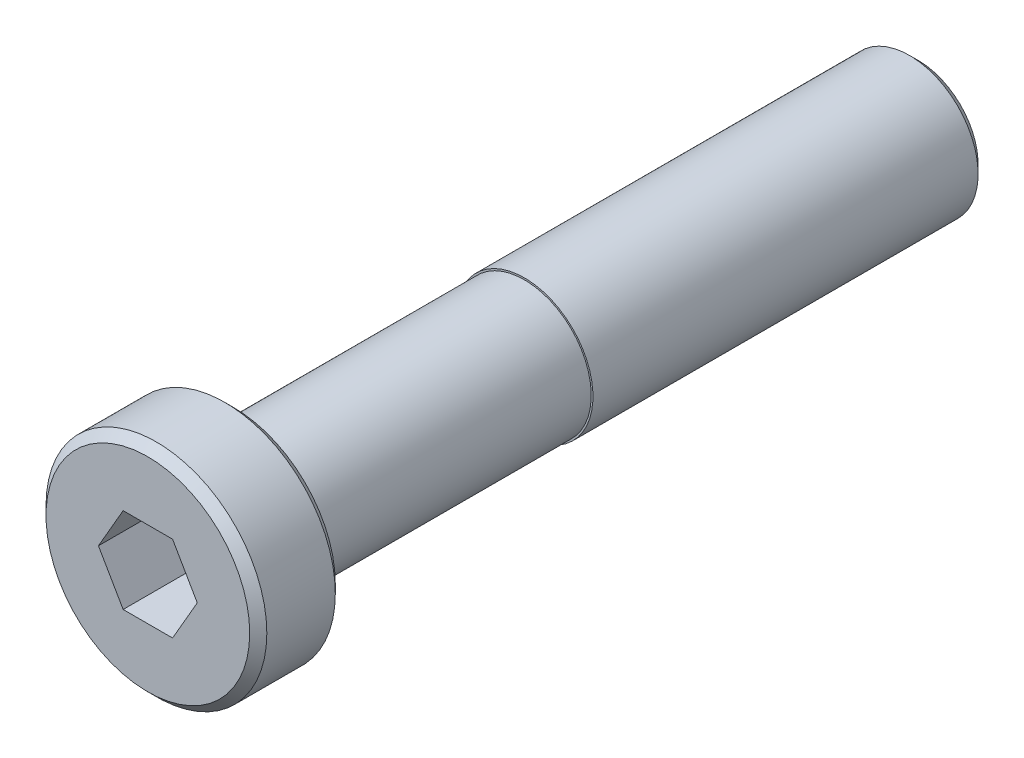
SolidWorks part; units mm, degrees
ref_plane "正面" through (0, 0, 0) normal (0, 0, 1) x (1, 0, 0)
ref_plane "平面" through (0, 0, 0) normal (0, 1, 0) x (1, 0, 0)
ref_plane "右側面" through (0, 0, 0) normal (1, 0, 0) x (0, 0, -1)
sketch "ｽｹｯﾁ1" plane through (0, 0, 0) normal (0, 0, 1) x (1, 0, 0)
  circle A0 centre (0, 0) radius 6.45
  dimension "D1" = 12.9
extrude "ﾎﾞｽ - 押し出し1" add sketch "ｽｹｯﾁ1" along normal blind 5
sketch "ｽｹｯﾁ2" plane through (0, 0, 0) normal (0, 0, -1) x (-1, 0, 0)
  circle A0 centre (0, 0) radius 3.9
  dimension "D1" = 7.8
extrude "ﾎﾞｽ - 押し出し2" add sketch "ｽｹｯﾁ2" along normal blind 40
sketch "ｽｹｯﾁ3" plane through (0, 0, 5) normal (0, 0, 1) x (1, 0, 0)
  line L1 (2.8868, 0) -> (1.4434, 2.5)
  line L2 (1.4434, 2.5) -> (-1.4434, 2.5)
  line L3 (-1.4434, 2.5) -> (-2.8868, 0)
  line L4 (-2.8868, 0) -> (-1.4434, -2.5)
  line L5 (-1.4434, -2.5) -> (1.4434, -2.5)
  line L6 (1.4434, -2.5) -> (2.8868, 0)
  circle A0 centre (0, 0) radius 2.5 construction
  dimension "D1" = 5
extrude "ｶｯﾄ - 押し出し1" cut sketch "ｽｹｯﾁ3" against normal blind 3.8
hole_wizard "Ø5.0 (5) 直径の穴1" positions "ｽｹｯﾁ4" profile "ｽｹｯﾁ6" hole size "Ø5.0" standard "JIS"
sketch "ｽｹｯﾁ4" plane through (0, 0, 5) normal (0, 0, 1) x (1, 0, 0)
  point P0 (0, 0)
sketch "ｽｹｯﾁ6" plane through (0, 0, 5) normal (1, 0, 0) x (0, -1, 0)
  line L0 (0, 0) -> (0, 5.3022)
  line L1 (0, 5.3022) -> (2.5, 3.8)
  line L2 (2.5, 3.8) -> (2.5, 0)
  line L5 (2.5, 0) -> (0, 0)
  line L10 (0, 5.3022) -> (-2.5, 3.8) construction
  line L11 (0, -6.35) -> (0, 107.95) construction
  dimension "穴の直径" = 5
  dimension "穴の深さ" = 3.8
  dimension "ﾄﾞﾘﾙ角度" = 118
chamfer "面取り2" distance 0.5 angle 45 2 edges at (6.45, 0, 0) (6.45, 0, 5)
sketch "ｽｹｯﾁ7" plane through (0, 0, -40) normal (0, 0, -1) x (-1, 0, 0)
  circle A0 centre (0, 0) radius 4
  dimension "D1" = 8
extrude "ﾎﾞｽ - 押し出し3" add sketch "ｽｹｯﾁ7" against normal blind 23
chamfer "面取り1" distance 0.5 angle 45 1 edges at (-4, 0, -40)
